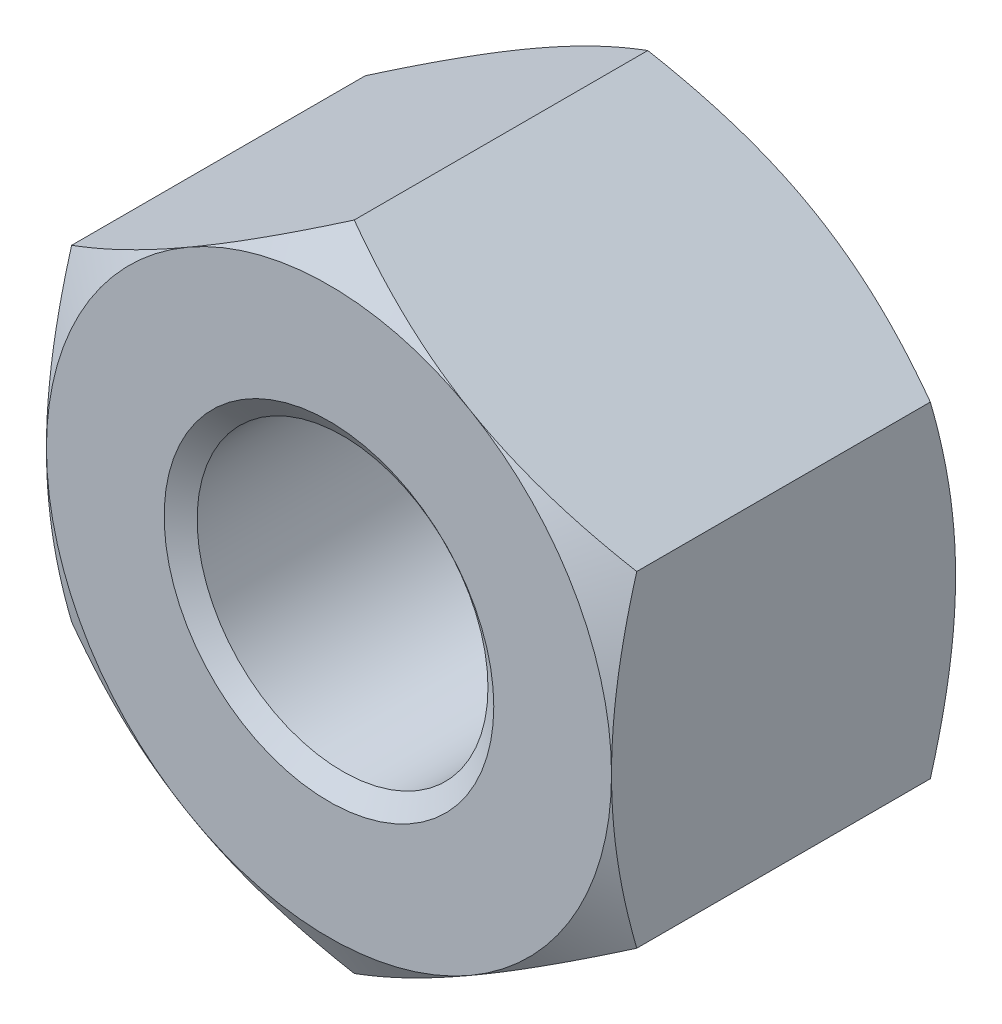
SolidWorks part; units mm, degrees
ref_plane "Plane1" through (0, 0, 0) normal (0, 0, 1) x (1, 0, 0)
ref_plane "Plane2" through (0, 0, 0) normal (0, 1, 0) x (1, 0, 0)
ref_plane "Plane3" through (0, 0, 0) normal (1, 0, 0) x (0, 0, -1)
sketch "BaseNutSke" plane through (0, 0, 0) normal (0, 0, 1) x (1, 0, 0)
  line L6 (17, 9.815) -> (17, -9.815)
  line L7 (-17, 9.815) -> (-17, -9.815)
  line L8 (17, 9.815) -> (0, 19.6299)
  line L9 (0, 19.6299) -> (-17, 9.815)
  line L10 (-17, -9.815) -> (0, -19.6299)
  line L11 (0, -19.6299) -> (17, -9.815)
  circle A0 centre (0, 0) radius 8.75
  dimension "D4" = 17
  dimension "Tap_drill" = 17.5
  dimension "D1" = 120
  dimension "D2" = 17
  dimension "D3" = 17
  dimension "Width_flats" = 34
extrude "BaseNut" add sketch "BaseNutSke" against normal blind 20.7
sketch "Sketch4" plane through (0, 0, 0) normal (1, 0, 0) x (0, 0, -1)
  line L0 (20.7, 17) -> (19.9, 17)
  line L1 (20.7, 17) -> (20.7, 29.6299)
  line L2 (19.9, 29.6299) -> (20.7, 29.6299)
  line L3 (19.9, 29.6299) -> (19.9, 17)
  line L4 (0, 0) -> (34.925, 0) construction
  line L6 (20.7, 9.815) -> (20.7, 19.6299) construction
  line L7 (0, 17) -> (-10, 17)
  line L8 (0, 9.815) -> (0, 19.6299) construction
  line L9 (1.5184, 19.6299) -> (1.5184, 29.6299)
  line L10 (1.5184, 29.6299) -> (-10, 29.6299)
  line L11 (-10, 29.6299) -> (-10, 17)
  line L12 (0, 17) -> (1.5184, 19.6299)
  line L14 (0, 9.815) -> (0, -9.815) construction
  line L15 (20.7, 19.6299) -> (0, 19.6299) construction
  dimension "D1" = 17
  dimension "D2" = 30
  dimension "Bearing_ht" = 0.8
  dimension "D3" = 10
  dimension "D4" = 10
revolve "Bearing-Face" [suppressed] cut sketch "Sketch4" angle 360 about L4
sketch "Sketch3" plane through (0, 0, 0) normal (1, 0, 0) x (0, 0, -1)
  line L0 (20.7, 17) -> (19.1816, 19.6299)
  line L1 (19.1816, 19.6299) -> (19.1816, 29.6299)
  line L2 (19.1816, 29.6299) -> (30.7, 29.6299)
  line L3 (30.7, 29.6299) -> (30.7, 17)
  line L4 (30.7, 17) -> (20.7, 17)
  line L5 (20.7, 9.815) -> (20.7, 19.6299) construction
  line L6 (20.7, 19.6299) -> (0, 19.6299) construction
  line L7 (0, 0) -> (38.6776, 0) construction
  line L8 (20.7, 0) -> (0, 0) construction
  line L9 (10.35, 19.6299) -> (10.35, 44.222) construction
  line L10 (1.5184, 29.6299) -> (-10, 29.6299)
  line L11 (-10, 29.6299) -> (-10, 17)
  line L12 (-10, 17) -> (0, 17)
  line L13 (0, 17) -> (1.5184, 19.6299)
  line L14 (1.5184, 19.6299) -> (1.5184, 29.6299)
  line L16 (20.7, 19.6299) -> (0, 19.6299) construction
  dimension "D1" = 17
  dimension "D2" = 30
  dimension "D3" = 10
  dimension "D4" = 10
revolve "Double-Chamfer" cut sketch "Sketch3" angle 360 about L7
sketch "ThdSchSke" plane through (0, 0, 0) normal (0, 1, 0) x (1, 0, 0)
  line L0 (-11.0172, 1.5875) -> (-8.75, 3.175)
  line L1 (-8.75, 3.175) -> (-4.375, 3.175)
  line L2 (-4.375, 3.175) -> (-4.375, 0)
  line L3 (-4.375, 0) -> (-8.75, 0)
  line L4 (-8.75, 0) -> (-11.0172, 1.5875)
  line L5 (-3.175, 3.175) -> (3.175, 3.175) construction
  line L6 (0, 3.175) -> (0, -2.9874) construction
  line L7 (0, 20.7) -> (0, 0) construction
  line L8 (-8.75, 0) -> (8.75, 0) construction
  dimension "VeeAngle" = 70
  dimension "SideAngle" = 55
  dimension "OverCut" = 8.75
  dimension "Advance" = 3.175
chamfer "Chamfer1" distance 1.1667 angle 35 2 edges at (8.75, 0, -20.7) (8.75, 0, 0)
revolve "ThreadSchematic" [suppressed] cut sketch "ThdSchSke" angle 360 about L6
pattern_linear "ThdSchPat" [suppressed]
equation "\"D2@BaseNutSke\" = \"Width_flats@BaseNutSke\" / 2"
equation "\"D3@BaseNutSke\" = \"Width_flats@BaseNutSke\" / 2"
equation "\"D1@Sketch3\" = \"Width_flats@BaseNutSke\" /2"
equation "\"D1@Sketch4\" = \"D2@BaseNutSke\""
equation "\"D4@BaseNutSke\" = \"D3@BaseNutSke\""
equation "\"Num_threads@ThdSchPat\" = int(  ( \"Thickness@BaseNut\" - 0.0508 ) / \"Advance@ThdSchSke\" + 0.999 )  + 1"
equation "\"Advance@ThdSchPat\" = ( \"Thickness@BaseNut\" - 0.0508 ) /  (\"Num_threads@ThdSchPat\" - 1) 'relax it"
equation "\"D1@Chamfer1\" = \"Tap_drill@BaseNutSke\"/15"
